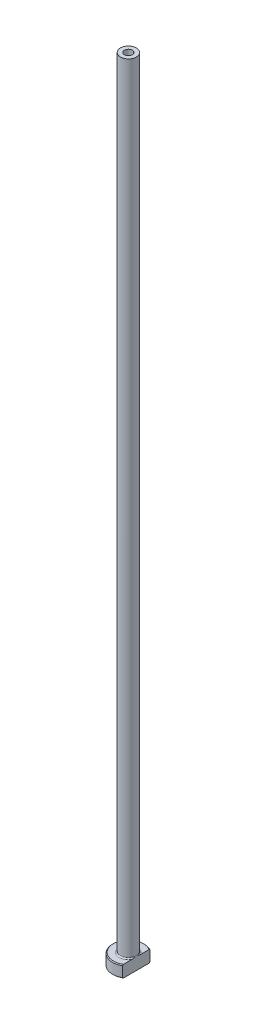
SolidWorks part; units mm, degrees
ref_plane "Front Plane" through (0, 0, 0) normal (0, 0, 1) x (1, 0, 0)
ref_plane "Top Plane" through (0, 0, 0) normal (0, 1, 0) x (1, 0, 0)
ref_plane "Right Plane" through (0, 0, 0) normal (1, 0, 0) x (0, 0, -1)
sketch "Sketch1" plane through (0, 0, 0) normal (0, 0, 1) x (1, 0, 0)
  line L0 (-1, 200) -> (-2, 200)
  line L1 (-2, 200) -> (-2, 3)
  line L2 (-2, 3) -> (-4, 3)
  line L3 (-4, 3) -> (-4, 0)
  line L4 (3.3, 0) -> (-3.3, 0) construction
  line L5 (-4, 0) -> (-1.25, 0)
  line L6 (-1, 165) -> (-1, 200)
  line L7 (0, 92.1877) -> (0, -15.5353) construction
  line L8 (0, -4.4) -> (0, 4.4) construction
  line L9 (-1, 165) -> (-1.25, 153)
  line L10 (-1.25, 153) -> (-1.25, 0)
  dimension "D1" = 0.25
  dimension "ID" = 2
  dimension "OD" = 4
  dimension "L" = 200
  dimension "H" = 8
  dimension "T" = 3
  dimension "N" = 35
  dimension "D2" = 12
  dimension "L-N" = 165
revolve "Revolve1" add sketch "Sketch1" angle 360 about L7
fillet "Fillet1" radius 0.3 1 edges at (0, 3, 2)
chamfer "Chamfer1" distance 0.2 angle 45 2 edges at (0, 3, 4) (0, 0, 4)
sketch "Sketch2" plane through (0, 0, 0) normal (0, -1, 0) x (1, 0, 0)
  line L0 (2, 3.4641) -> (2, -3.4641)
  circle A0 centre (0, 0) radius 4 construction
  arc A1 (2, 3.4641) -> (2, -3.4641) centre (0, 0) cw
  circle A2 centre (0, 0) radius 2 construction
extrude "Cut-Extrude1" cut sketch "Sketch2" against normal through all
chamfer "Chamfer2" distance 0.5 angle 45 1 edges at (0, 0, 1.25)
